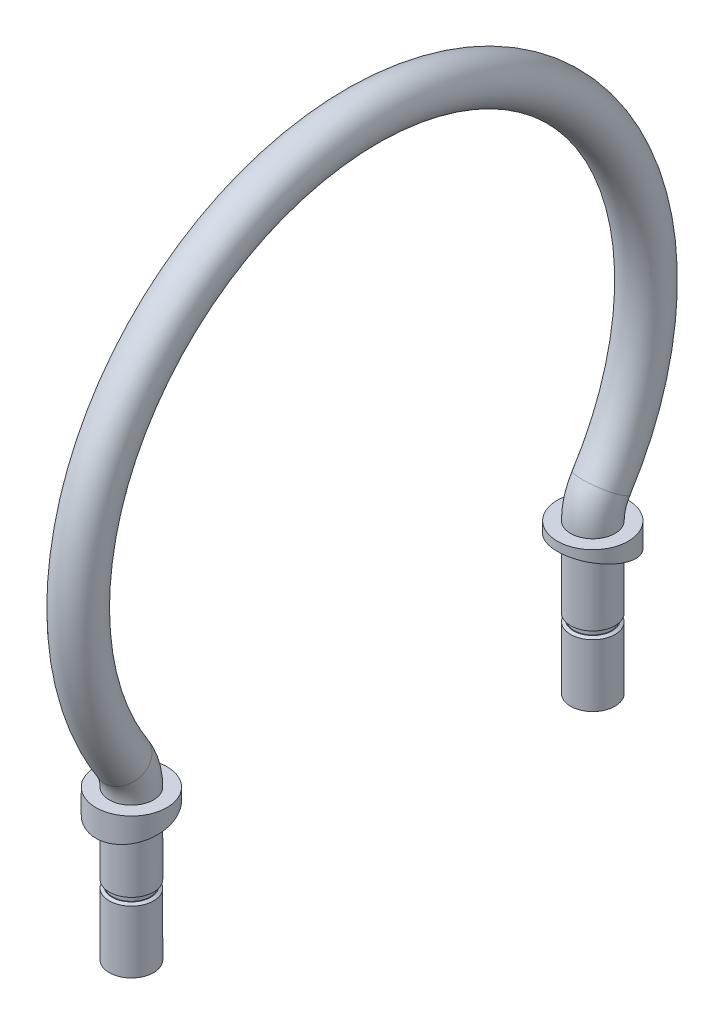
SolidWorks part; units mm, degrees
ref_plane "Front" through (0, 0, 0) normal (0, 0, 1) x (1, 0, 0)
ref_plane "Top" through (0, 0, 0) normal (0, 1, 0) x (1, 0, 0)
ref_plane "Right" through (0, 0, 0) normal (1, 0, 0) x (0, 0, -1)
sketch "Sketch2" plane through (0, 0, 0) normal (1, 0, 0) x (0, 0, -1)
  arc A0 (42.7789, 5.137) -> (-42.7789, 5.137) centre (0, 32.5341) ccw
  arc A1 (42.7789, 5.137) -> (41.275, 0) centre (50.8, 0) ccw
  arc A2 (-41.275, 0) -> (-42.7789, 5.137) centre (-50.8, 0) ccw
  dimension "D1" = 101.6
  dimension "D2" = 9.525
  dimension "D3" = 82.55
sketch "Sketch5" plane through (0, 0, 0) normal (0, 1, 0) x (1, 0, 0)
  circle A0 centre (0, 41.275) radius 3.9688
  dimension "D1" = 7.9375
sweep "Sweep1" add profiles "Sketch5" path "Sketch2"
sketch "Sketch7" plane through (0, 0, 0) normal (0, 1, 0) x (1, 0, 0)
  circle A0 centre (0, 41.275) radius 6.35
  circle A1 centre (0, -41.275) radius 6.35
  dimension "D1" = 12.7
extrude "Extrude4" add sketch "Sketch7" against normal blind 4.7625
sketch "Sketch8" plane through (0, 0, 0) normal (1, 0, 0) x (0, 0, -1)
  line L0 (-34.925, -1.5875) -> (-47.625, -4.7625)
  line L2 (-47.625, -4.7625) -> (-34.925, -4.7625)
  line L3 (-34.925, -4.7625) -> (-34.925, -1.5875)
  line L4 (34.925, -1.5875) -> (47.625, -4.7625)
  line L6 (47.625, -4.7625) -> (34.925, -4.7625)
  line L7 (34.925, -4.7625) -> (34.925, -1.5875)
  line L8 (-34.925, 0) -> (-47.625, 0) construction
  line L9 (47.625, 0) -> (34.925, 0) construction
  dimension "D1" = 1.5875
  dimension "D2" = 1.5875
extrude "Extrude5" cut sketch "Sketch8" against normal through all and the other way through all
sketch "Sketch9" plane through (0, 0, 0) normal (0, 1, 0) x (1, 0, 0)
  circle A0 centre (0, -41.275) radius 3.9688
  circle A1 centre (0, 41.275) radius 3.9688 construction
  circle A2 centre (0, 41.275) radius 3.9688
extrude "Extrude6" add sketch "Sketch9" against normal blind 14.2875
sketch "Sketch10" plane through (0, -14.2875, 0) normal (0, -1, 0) x (1, 0, 0)
  circle A0 centre (0, -41.275) radius 3.3388
  circle A1 centre (0, 41.275) radius 3.3388
  dimension "D1" = 6.6777
extrude "Extrude7" add sketch "Sketch10" along normal blind 1.0583
sketch "Sketch11" plane through (0, -15.3458, 0) normal (0, -1, 0) x (1, 0, 0)
  circle A0 centre (0, -41.275) radius 3.9688
  circle A1 centre (0, 41.275) radius 3.9688
  dimension "D1" = 7.9375
extrude "Extrude8" add sketch "Sketch11" along normal blind 11.8872
chamfer "Chamfer1" distance 0.7937 angle 30 2 edges at (0, -27.233, 37.3062) (0, -27.233, -45.2437)
chamfer "Chamfer2" distance 0.508 angle 30 2 edges at (0, -15.3458, 37.3062) (0, -15.3458, -45.2437)
sketch "Sketch12" plane through (0, 0, 0) normal (0, 0, 1) x (1, 0, 0)
  line L1 (-42.471, 96.2892) -> (28.1923, 96.2892)
  line L2 (-42.471, 96.2892) -> (-42.471, -46.8928)
  line L3 (-42.471, -46.8928) -> (28.1923, -46.8928)
  line L4 (28.1923, 96.2892) -> (28.1923, -46.8928)
extrude "FEA cut" [suppressed] cut sketch "Sketch12" against normal through all
equation "\"Buoyancy\"=\"SW-Volume\"*(\"SW-Density\"-.037062)"
